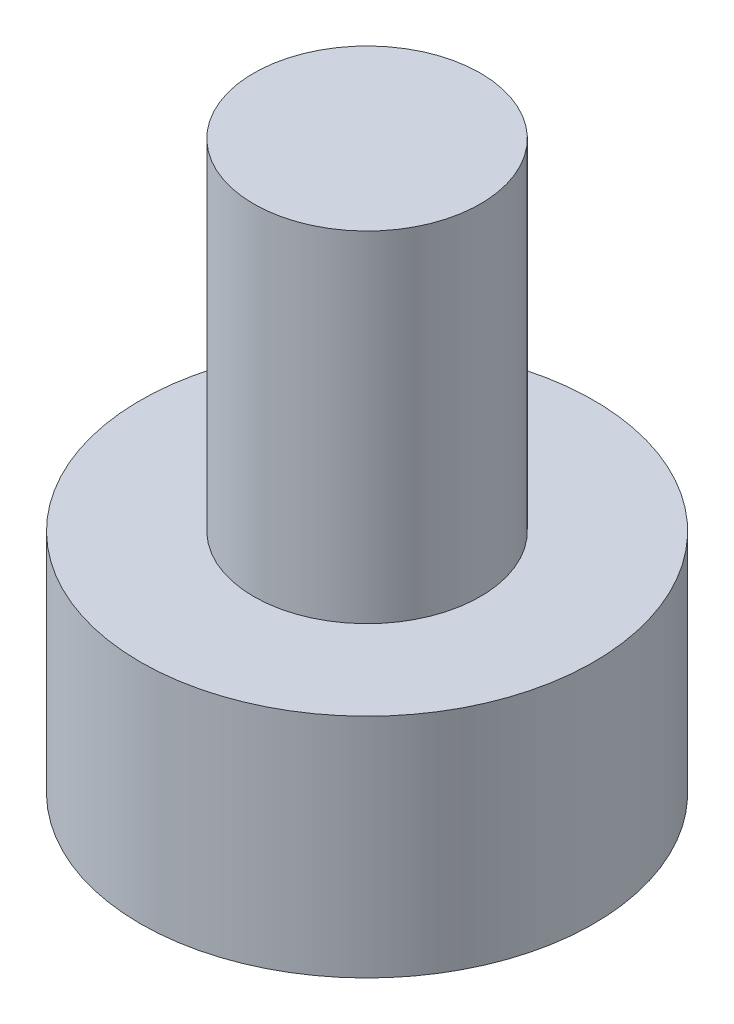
SolidWorks part; units mm, degrees
ref_plane "Front Plane" through (0, 0, 0) normal (0, 0, 1) x (1, 0, 0)
ref_plane "Top Plane" through (0, 0, 0) normal (0, 1, 0) x (1, 0, 0)
ref_plane "Right Plane" through (0, 0, 0) normal (1, 0, 0) x (0, 0, -1)
sketch "Sketch1" plane through (0, 0, 0) normal (0, 1, 0) x (1, 0, 0)
  circle A0 centre (0, 0) radius 8
  dimension "D1" = 16
extrude "Boss-Extrude1" add sketch "Sketch1" along normal blind 8
sketch "Sketch2" plane through (0, 8, 0) normal (0, 1, 0) x (1, 0, 0)
  circle A0 centre (0, 0) radius 4
  dimension "D1" = 8
extrude "Boss-Extrude2" add sketch "Sketch2" along normal blind 12
